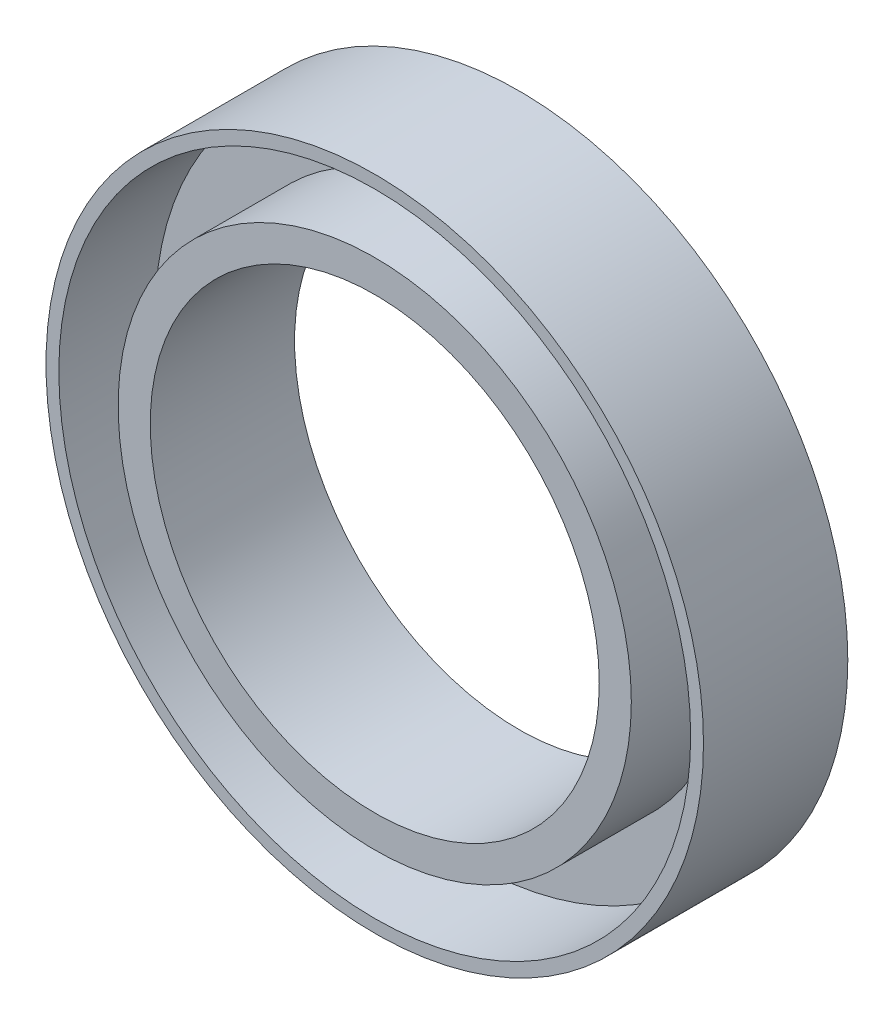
SolidWorks part; units mm, degrees
ref_plane "Plan de face" through (0, 0, 0) normal (0, 0, 1) x (1, 0, 0)
ref_plane "Plan de dessus" through (0, 0, 0) normal (0, 1, 0) x (1, 0, 0)
ref_plane "Plan de droite" through (0, 0, 0) normal (1, 0, 0) x (0, 0, -1)
sketch "Esquisse1" plane through (0, 0, 0) normal (0, 0, 1) x (1, 0, 0)
  circle A0 centre (0, 0) radius 10.25
  circle A1 centre (0, 0) radius 7
  dimension "D1" = 14
  dimension "D2" = 20.5
extrude "Boss.-Extru.1" add sketch "Esquisse1" along normal blind 1.5
sketch "Esquisse2" plane through (0, 0, 1.5) normal (0, 0, 1) x (1, 0, 0)
  circle A0 centre (0, 0) radius 7
  circle A1 centre (0, 0) radius 8
  circle A2 centre (0, 0) radius 7 construction
  dimension "D1" = 1
extrude "Boss.-Extru.2" add sketch "Esquisse2" along normal blind 3
sketch "Esquisse3" plane through (0, 0, 1.5) normal (0, 0, 1) x (1, 0, 0)
  circle A0 centre (0, 0) radius 10.25
  circle A1 centre (0, 0) radius 9.85
  circle A2 centre (0, 0) radius 10.25 construction
  dimension "D1" = 0.4
extrude "Boss.-Extru.3" add sketch "Esquisse3" along normal blind 3
